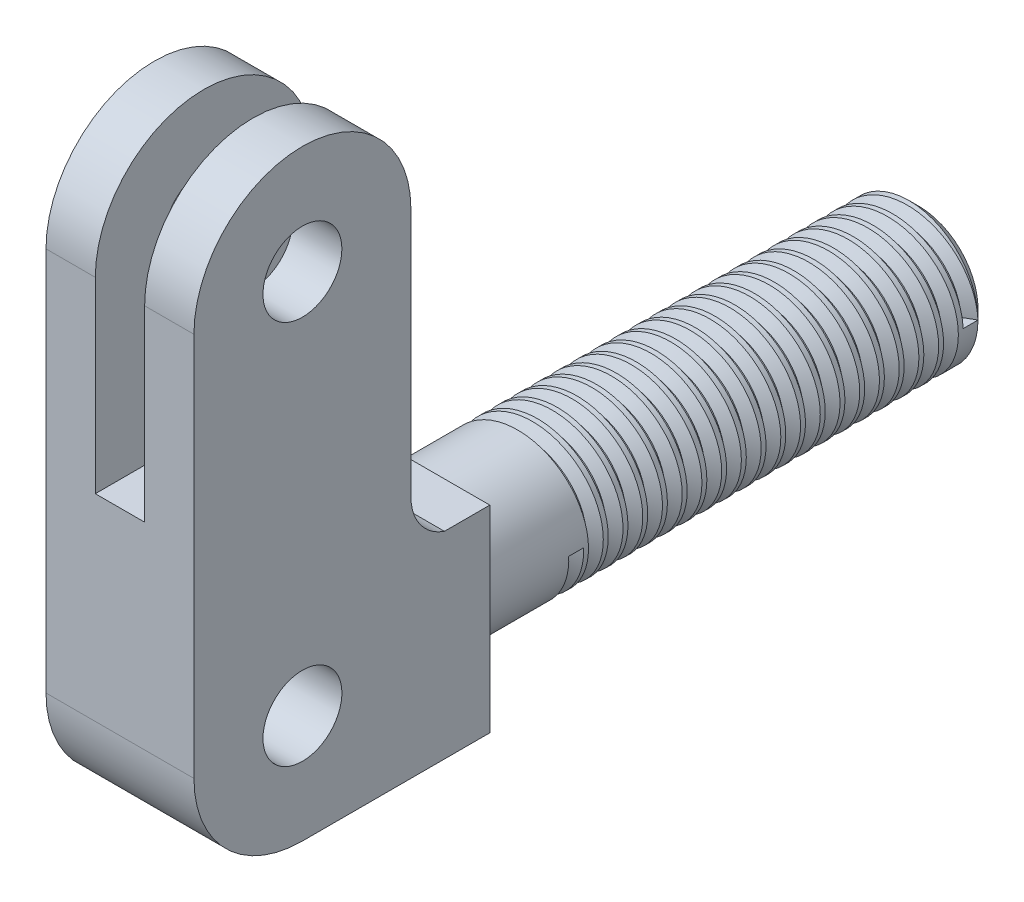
SolidWorks part; units mm, degrees
ref_plane "Front Plane" through (0, 0, 0) normal (0, 0, 1) x (1, 0, 0)
ref_plane "Top Plane" through (0, 0, 0) normal (0, 1, 0) x (1, 0, 0)
ref_plane "Right Plane" through (0, 0, 0) normal (1, 0, 0) x (0, 0, -1)
ref_plane "Plane1" through (-7.5, 0, 0) normal (-1, 0, 0) x (0, -1, 0)
sketch "Sketch1" plane through (-7.5, 0, 0) normal (-1, 0, 0) x (0, -1, 0)
  line L0 (-20, 4.6034) -> (-20, 30)
  line L1 (-20, 30) -> (-50, 30)
  line L2 (-50, 8) -> (-24.7359, 8)
  arc A0 (-50, 30) -> (-50, 8) centre (-50, 19) ccw
  arc A1 (-24.7359, 8) -> (-20, 4.6034) centre (-24.7359, 3) cw
extrude "Boss-Extrude1" add sketch "Sketch1" against normal blind 10
sketch "Sketch2" plane through (0, 20, 0) normal (0, -1, 0) x (1, 0, 0)
  line L0 (2.5, 0) -> (-7.5, 0)
  line L1 (-7.5, 0) -> (-7.5, 30)
  line L2 (-7.5, 30) -> (2.5, 30)
  line L3 (2.5, 30) -> (2.5, 0)
extrude "Boss-Extrude2" add sketch "Sketch2" along normal blind 20
ref_plane "Plane2" through (0, 50, 0) normal (0, 1, 0) x (1, 0, 0)
sketch "Sketch3" plane through (0, 50, 0) normal (0, 1, 0) x (1, 0, 0)
  line L0 (2.5, -8) -> (-2.5, -8)
  line L1 (-2.5, -8) -> (-2.5, -30)
  line L2 (-2.5, -30) -> (2.5, -30)
  line L3 (2.5, -30) -> (2.5, -8)
extrude "Cut-Extrude1" cut sketch "Sketch3" against normal blind 19 and the other way through all
sketch "Sketch4" plane through (2.5, 0, 0) normal (1, 0, 0) x (0, 0, -1)
  line L0 (-30, 0) -> (-30, 50)
  line L1 (-8, 50) -> (-8, 24.7359)
  line L2 (-4.6034, 20) -> (0, 20)
  line L3 (0, 20) -> (0, 0)
  line L4 (0, 0) -> (-30, 0)
  arc A0 (-30, 50) -> (-8, 50) centre (-19, 50) cw
  arc A1 (-8, 24.7359) -> (-4.6034, 20) centre (-3, 24.7359) ccw
extrude "Boss-Extrude3" add sketch "Sketch4" along normal blind 5
ref_plane "Plane3" through (0, 11, 0) normal (0, -1, 0) x (1, 0, 0)
sketch "Sketch5" plane through (0, 11, 0) normal (0, -1, 0) x (1, 0, 0)
  line L0 (7, 0) -> (0, 0)
  line L1 (0, 0) -> (0, -51)
  line L2 (0, -51) -> (7, -51)
  line L3 (7, -51) -> (7, 0)
  line L4 (0, 0) -> (0, -51) construction
revolve "Revolve1" add sketch "Sketch5" angle 360 about L4
hole_wizard "Ø8.0 (8) Diameter Hole1" positions "Sketch7" profile "Sketch6" hole size "Ø8.0" standard "ANSI Metric"
sketch "Sketch7" plane through (7.5, 0, 0) normal (1, 0, 0) x (0, 0, -1)
  point P0 (-19, 50)
sketch "Sketch6" plane through (7.5, 50, 19) normal (0, 1, 0) x (0, 0, -1)
  line L0 (0, 0) -> (0, 5)
  line L1 (0, 5) -> (4, 5)
  line L2 (4, 5) -> (4, 0)
  line L5 (4, 0) -> (0, 0)
  line L10 (0, 5) -> (-4, 5) construction
  line L11 (0, -6.35) -> (0, 107.95) construction
  dimension "Hole Dia." = 8
  dimension "Hole Depth" = 5
  dimension "Drill Angle" = 180
hole_wizard "Ø8.0 (8) Diameter Hole2" positions "Sketch9" profile "Sketch8" hole size "Ø8.0" standard "ANSI Metric"
sketch "Sketch9" plane through (-7.5, 0, 0) normal (-1, 0, 0) x (0, 0, 1)
  point P0 (19, 11)
sketch "Sketch8" plane through (-7.5, 11, 19) normal (0, 1, 0) x (0, 0, 1)
  line L0 (0, 0) -> (0, 15)
  line L1 (0, 15) -> (4, 15)
  line L2 (4, 15) -> (4, 0)
  line L5 (4, 0) -> (0, 0)
  line L11 (0, -6.35) -> (0, 107.95) construction
  dimension "Thru Hole Dia." = 8
  dimension "Thru Hole Depth" = 15
hole_wizard "Ø8.0 (8) Diameter Hole3" positions "Sketch11" profile "Sketch10" hole size "Ø8.0" standard "ANSI Metric"
sketch "Sketch11" plane through (-7.5, 0, 0) normal (-1, 0, 0) x (0, 0, 1)
  point P0 (19, 50)
sketch "Sketch10" plane through (-7.5, 50, 19) normal (0, 1, 0) x (0, 0, 1)
  line L0 (0, 0) -> (0, 5)
  line L1 (0, 5) -> (4, 5)
  line L2 (4, 5) -> (4, 0)
  line L5 (4, 0) -> (0, 0)
  line L10 (0, 5) -> (-4, 5) construction
  line L11 (0, -6.35) -> (0, 107.95) construction
  dimension "Hole Dia." = 8
  dimension "Hole Depth" = 5
  dimension "Drill Angle" = 180
chamfer "Chamfer1" distance 1 angle 45 1 edges at (-7, 11, -51)
fillet "Fillet1" radius 11 1 edges at (0, 0, 30)
thread "Thread2" pitch 2 start angle 0, offset 0, length 40, pitch 2, diameter 14
ref_plane "Plane9" through (7, 11, -50) normal (0, -1, 0) x (1, 0, 0)
sketch "Thread Profile6" plane through (7, 11, -50) normal (0, -1, 0) x (1, 0, 0)
  line L0 (0, 0) -> (0, 2) construction
  line L1 (0, 1.5) -> (-1.0825, 0.875)
  line L2 (-1.0825, 0.875) -> (-1.0825, 0.625)
  line L3 (-1.0825, 0.625) -> (0, 0)
  line L4 (-1.0825, 0.75) -> (0, 0.75) construction
  line L11 (0, 1.5) -> (0, 0)
  point P6 (0, 0)
  dimension "Pitch" = 2
  dimension "Profile_Angle" = 60
  dimension "Profile_Land" = 0.25
  dimension "Profile_Height" = 1.0825
